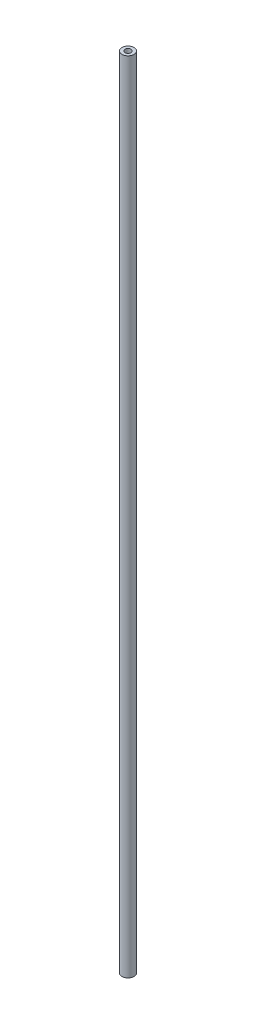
SolidWorks part; units mm, degrees
ref_plane "Front Plane" through (0, 0, 0) normal (0, 0, 1) x (1, 0, 0)
ref_plane "Top Plane" through (0, 0, 0) normal (0, 1, 0) x (1, 0, 0)
ref_plane "Right Plane" through (0, 0, 0) normal (1, 0, 0) x (0, 0, -1)
sketch "Sketch1" plane through (0, 0, 0) normal (0, 1, 0) x (1, 0, 0)
  circle A0 centre (0, 0) radius 6.35
  circle A1 centre (0, 0) radius 3.175
  dimension "D1" = 6.35
  dimension "D2" = 12.7
extrude "Boss-Extrude1" add sketch "Sketch1" along normal up to surface (842.01 mm away)
